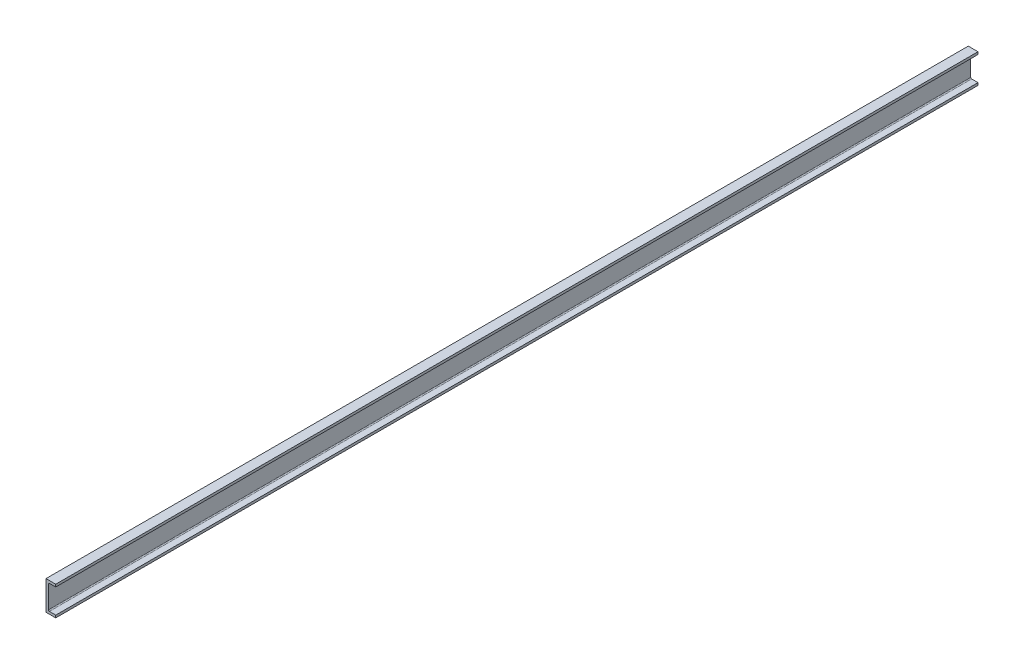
SolidWorks part; units mm, degrees
ref_plane "Front Plane" through (0, 0, 0) normal (0, 0, 1) x (1, 0, 0)
ref_plane "Top Plane" through (0, 0, 0) normal (0, 1, 0) x (1, 0, 0)
ref_plane "Right Plane" through (0, 0, 0) normal (1, 0, 0) x (0, 0, -1)
sketch "Sketch1" plane through (0, 0, 0) normal (0, 0, 1) x (1, 0, 0)
  line L0 (0, 0) -> (0, 76.2)
  line L1 (0, 76.2) -> (25.4, 76.2)
  line L2 (25.4, 76.2) -> (25.4, 69.85)
  line L3 (25.4, 69.85) -> (6.35, 69.85)
  line L4 (6.35, 69.85) -> (6.35, 6.35)
  line L5 (6.35, 6.35) -> (25.4, 6.35)
  line L6 (25.4, 6.35) -> (25.4, 0)
  line L7 (25.4, 0) -> (0, 0)
  dimension "D1" = 76.2
  dimension "D2" = 25.4
  dimension "D3" = 6.35
  dimension "D4" = 19.05
  dimension "D5" = 6.35
extrude "Boss-Extrude1" add sketch "Sketch1" against normal blind 2406.65
fillet "Fillet1" radius 2.54 2 edges at (6.35, 6.35, -1203.325) (6.35, 69.85, -1203.325)
